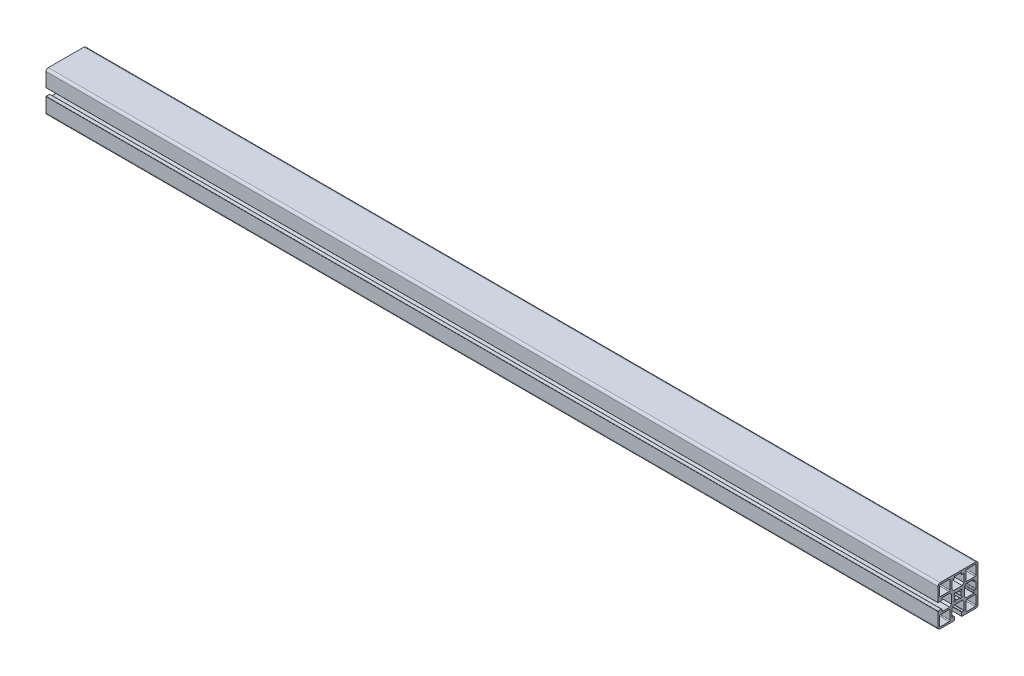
SolidWorks part; units mm, degrees
ref_plane "Front Plane" through (0, 0, 0) normal (0, 0, 1) x (1, 0, 0)
ref_plane "Top Plane" through (0, 0, 0) normal (0, 1, 0) x (1, 0, 0)
ref_plane "Right Plane" through (0, 0, 0) normal (1, 0, 0) x (0, 0, -1)
sketch3d "3DSketch1"
  line L0 (0, 0, 0) -> (1000, 0, 0)
  dimension "D1" = 1000
other "45-sarja 1.0175 45X45 L 2SS VAHV(1)"
ref_plane "Plane1" through (0, 0, 0) normal (1, 0, 0) x (0, -1, 0)
sketch "Model" plane through (0, 0, 0) normal (1, 0, 0) x (0, -1, 0)
  line L0 (6.5, 18) -> (4.6, 18)
  line L1 (4.1, 18.5) -> (4.1, 20.2)
  line L2 (-9.8, 20.5) -> (-19.5, 20.5)
  line L3 (-20.5, -9.8) -> (-20.5, -19.5)
  line L5 (-4.1, 20.2) -> (-4.1, 18.5)
  line L6 (-4.6, 18) -> (-6.5, 18)
  line L7 (-6.8, 17.7) -> (-6.8, 9.2)
  line L8 (-6.8, 9.2) -> (-4.8, 7.2)
  line L9 (-4.8, 7.2) -> (4.8, 7.2)
  line L10 (4.8, 7.2) -> (6.8, 9.2)
  line L11 (6.8, 9.2) -> (6.8, 17.7)
  line L12 (20.5, 9.8) -> (20.5, 19.5)
  line L13 (19.5, 20.5) -> (9.8, 20.5)
  line L14 (8.8, 19.5) -> (8.8, 9.8)
  line L15 (9.8, 8.8) -> (19.5, 8.8)
  line L16 (3.8, 20.5) -> (-3.8, 20.5)
  line L17 (-20.5, 19.5) -> (-20.5, 9.8)
  line L18 (-19.5, 8.8) -> (-9.8, 8.8)
  line L19 (-8.8, 9.8) -> (-8.8, 19.5)
  line L20 (3.3633, 1.9491) -> (4.3841, 2.9698)
  line L21 (4.3841, 3.3941) -> (3.3941, 4.3841)
  line L22 (2.9698, 4.3841) -> (1.9491, 3.3633)
  line L23 (-1.9491, 3.3633) -> (-2.9698, 4.3841)
  line L24 (-3.3941, 4.3841) -> (-4.3841, 3.3941)
  line L25 (-4.3841, 2.9698) -> (-3.3633, 1.9491)
  line L26 (-3.3633, -1.9491) -> (-4.3841, -2.9698)
  line L27 (-4.3841, -3.3941) -> (-3.3941, -4.3841)
  line L28 (-2.9698, -4.3841) -> (-1.9491, -3.3633)
  line L29 (1.9491, -3.3633) -> (2.9698, -4.3841)
  line L30 (3.3941, -4.3841) -> (4.3841, -3.3941)
  line L31 (4.3841, -2.9698) -> (3.3633, -1.9491)
  line L32 (19.5, -8.8) -> (9.8, -8.8)
  line L33 (8.8, -9.8) -> (8.8, -19.5)
  line L34 (9.8, -20.5) -> (19.5, -20.5)
  line L35 (20.5, -19.5) -> (20.5, -9.8)
  line L36 (-19.5, -20.5) -> (-9.8, -20.5)
  line L37 (-8.8, -19.5) -> (-8.8, -9.8)
  line L38 (-9.8, -8.8) -> (-19.5, -8.8)
  line L39 (-20.5, 3.8) -> (-20.5, -3.8)
  line L40 (-4.6, -18) -> (-6.5, -18)
  line L41 (-4.1, -22.2) -> (-4.1, -18.5)
  line L42 (-20, -22.5) -> (-4.4, -22.5)
  line L43 (-22.5, 20) -> (-22.5, -20)
  line L44 (-18.5, -4.1) -> (-20.2, -4.1)
  line L45 (-18, -6.5) -> (-18, -4.6)
  line L46 (-9.2, -6.8) -> (-17.7, -6.8)
  line L47 (-7.2, -4.8) -> (-9.2, -6.8)
  line L48 (-7.2, 4.8) -> (-7.2, -4.8)
  line L49 (-9.2, 6.8) -> (-7.2, 4.8)
  line L50 (-17.7, 6.8) -> (-9.2, 6.8)
  line L51 (-18, 4.6) -> (-18, 6.5)
  line L52 (-20.2, 4.1) -> (-18.5, 4.1)
  line L54 (20, 22.5) -> (-20, 22.5)
  line L55 (22.5, 4.4) -> (22.5, 20)
  line L56 (18.5, 4.1) -> (22.2, 4.1)
  line L57 (18, 6.5) -> (18, 4.6)
  line L58 (9.2, 6.8) -> (17.7, 6.8)
  line L59 (7.2, 4.8) -> (9.2, 6.8)
  line L60 (7.2, -4.8) -> (7.2, 4.8)
  line L61 (9.2, -6.8) -> (7.2, -4.8)
  line L62 (17.7, -6.8) -> (9.2, -6.8)
  line L63 (18, -4.6) -> (18, -6.5)
  line L64 (22.2, -4.1) -> (18.5, -4.1)
  line L65 (22.5, -20) -> (22.5, -4.4)
  line L66 (4.4, -22.5) -> (20, -22.5)
  line L67 (4.1, -18.5) -> (4.1, -22.2)
  line L68 (6.5, -18) -> (4.6, -18)
  line L69 (6.8, -9.2) -> (6.8, -17.7)
  line L70 (4.8, -7.2) -> (6.8, -9.2)
  line L71 (-4.8, -7.2) -> (4.8, -7.2)
  line L72 (-6.8, -9.2) -> (-4.8, -7.2)
  line L73 (-6.8, -17.7) -> (-6.8, -9.2)
  arc A0 (4.1, 18.5) -> (4.6, 18) centre (4.6, 18.5) ccw
  arc A1 (-4.1, 20.2) -> (-3.8, 20.5) centre (-3.8, 20.2) cw
  arc A2 (3.8, 20.5) -> (4.1, 20.2) centre (3.8, 20.2) cw
  arc A3 (-4.6, 18) -> (-4.1, 18.5) centre (-4.6, 18.5) ccw
  arc A4 (-6.5, 18) -> (-6.8, 17.7) centre (-6.5, 17.7) ccw
  arc A5 (6.8, 17.7) -> (6.5, 18) centre (6.5, 17.7) ccw
  arc A6 (19.5, 8.8) -> (20.5, 9.8) centre (19.5, 9.8) ccw
  arc A7 (20.5, 19.5) -> (19.5, 20.5) centre (19.5, 19.5) ccw
  arc A8 (9.8, 20.5) -> (8.8, 19.5) centre (9.8, 19.5) ccw
  arc A9 (8.8, 9.8) -> (9.8, 8.8) centre (9.8, 9.8) ccw
  arc A10 (-8.8, 19.5) -> (-9.8, 20.5) centre (-9.8, 19.5) ccw
  arc A11 (-19.5, 20.5) -> (-20.5, 19.5) centre (-19.5, 19.5) ccw
  arc A12 (-20.5, 9.8) -> (-19.5, 8.8) centre (-19.5, 9.8) ccw
  arc A13 (-9.8, 8.8) -> (-8.8, 9.8) centre (-9.8, 9.8) ccw
  arc A14 (4.3841, 2.9698) -> (4.3841, 3.3941) centre (4.1719, 3.182) ccw
  arc A15 (3.3941, 4.3841) -> (2.9698, 4.3841) centre (3.182, 4.1719) ccw
  arc A16 (1.6059, 3.3056) -> (1.9491, 3.3633) centre (1.7369, 3.5754) ccw
  arc A17 (1.6059, 3.3056) -> (-1.6059, 3.3056) centre (0, 0) ccw
  arc A18 (-1.9491, 3.3633) -> (-1.6059, 3.3056) centre (-1.7369, 3.5754) ccw
  arc A19 (-2.9698, 4.3841) -> (-3.3941, 4.3841) centre (-3.182, 4.1719) ccw
  arc A20 (-4.3841, 3.3941) -> (-4.3841, 2.9698) centre (-4.1719, 3.182) ccw
  arc A21 (-3.3056, 1.6059) -> (-3.3633, 1.9491) centre (-3.5754, 1.7369) ccw
  arc A22 (-3.3056, 1.6059) -> (-3.3056, -1.6059) centre (0, 0) ccw
  arc A23 (-3.3633, -1.9491) -> (-3.3056, -1.6059) centre (-3.5754, -1.7369) ccw
  arc A24 (-4.3841, -2.9698) -> (-4.3841, -3.3941) centre (-4.1719, -3.182) ccw
  arc A25 (-3.3941, -4.3841) -> (-2.9698, -4.3841) centre (-3.182, -4.1719) ccw
  arc A26 (-1.6059, -3.3056) -> (-1.9491, -3.3633) centre (-1.7369, -3.5754) ccw
  arc A27 (-1.6059, -3.3056) -> (1.6059, -3.3056) centre (0, 0) ccw
  arc A28 (1.9491, -3.3633) -> (1.6059, -3.3056) centre (1.7369, -3.5754) ccw
  arc A29 (2.9698, -4.3841) -> (3.3941, -4.3841) centre (3.182, -4.1719) ccw
  arc A30 (4.3841, -3.3941) -> (4.3841, -2.9698) centre (4.1719, -3.182) ccw
  arc A31 (3.3056, -1.6059) -> (3.3633, -1.9491) centre (3.5754, -1.7369) ccw
  arc A32 (3.3056, -1.6059) -> (3.3056, 1.6059) centre (0, 0) ccw
  arc A33 (3.3633, 1.9491) -> (3.3056, 1.6059) centre (3.5754, 1.7369) ccw
  arc A34 (20.5, -9.8) -> (19.5, -8.8) centre (19.5, -9.8) ccw
  arc A35 (9.8, -8.8) -> (8.8, -9.8) centre (9.8, -9.8) ccw
  arc A36 (8.8, -19.5) -> (9.8, -20.5) centre (9.8, -19.5) ccw
  arc A37 (19.5, -20.5) -> (20.5, -19.5) centre (19.5, -19.5) ccw
  arc A38 (-20.5, -19.5) -> (-19.5, -20.5) centre (-19.5, -19.5) ccw
  arc A39 (-9.8, -20.5) -> (-8.8, -19.5) centre (-9.8, -19.5) ccw
  arc A40 (-8.8, -9.8) -> (-9.8, -8.8) centre (-9.8, -9.8) ccw
  arc A41 (-19.5, -8.8) -> (-20.5, -9.8) centre (-19.5, -9.8) ccw
  arc A42 (-4.1, -18.5) -> (-4.6, -18) centre (-4.6, -18.5) ccw
  arc A43 (-4.4, -22.5) -> (-4.1, -22.2) centre (-4.4, -22.2) ccw
  arc A44 (-22.5, -20) -> (-20, -22.5) centre (-20, -20) ccw
  arc A46 (-18, -4.6) -> (-18.5, -4.1) centre (-18.5, -4.6) ccw
  arc A47 (-18, -6.5) -> (-17.7, -6.8) centre (-17.7, -6.5) ccw
  arc A48 (-17.7, 6.8) -> (-18, 6.5) centre (-17.7, 6.5) ccw
  arc A49 (-18.5, 4.1) -> (-18, 4.6) centre (-18.5, 4.6) ccw
  arc A51 (-20, 22.5) -> (-22.5, 20) centre (-20, 20) ccw
  arc A52 (22.5, 20) -> (20, 22.5) centre (20, 20) ccw
  arc A53 (22.2, 4.1) -> (22.5, 4.4) centre (22.2, 4.4) ccw
  arc A54 (18, 4.6) -> (18.5, 4.1) centre (18.5, 4.6) ccw
  arc A55 (18, 6.5) -> (17.7, 6.8) centre (17.7, 6.5) ccw
  arc A56 (17.7, -6.8) -> (18, -6.5) centre (17.7, -6.5) ccw
  arc A57 (18.5, -4.1) -> (18, -4.6) centre (18.5, -4.6) ccw
  arc A58 (22.5, -4.4) -> (22.2, -4.1) centre (22.2, -4.4) ccw
  arc A59 (20, -22.5) -> (22.5, -20) centre (20, -20) ccw
  arc A60 (4.1, -22.2) -> (4.4, -22.5) centre (4.4, -22.2) ccw
  arc A61 (4.6, -18) -> (4.1, -18.5) centre (4.6, -18.5) ccw
  arc A62 (6.5, -18) -> (6.8, -17.7) centre (6.5, -17.7) ccw
  arc A63 (-6.8, -17.7) -> (-6.5, -18) centre (-6.5, -17.7) ccw
  arc A65 (-20.2, -4.1) -> (-20.5, -3.8) centre (-20.2, -3.8) cw
  arc A66 (-20.5, 3.8) -> (-20.2, 4.1) centre (-20.2, 3.8) cw
  point P181 (0, 0)
  point P199 (0, 0)
  point P200 (0, 22.5)
  point P201 (-22.5, 0)
  point P202 (22.5, 0)
  point P203 (0, -22.5)
  point P204 (-22.5, 22.5)
  point P205 (22.5, 22.5)
  point P206 (22.5, -22.5)
  point P207 (-22.5, -22.5)
  point P211 (-21, 0)
  dimension "D1" = 0.3
